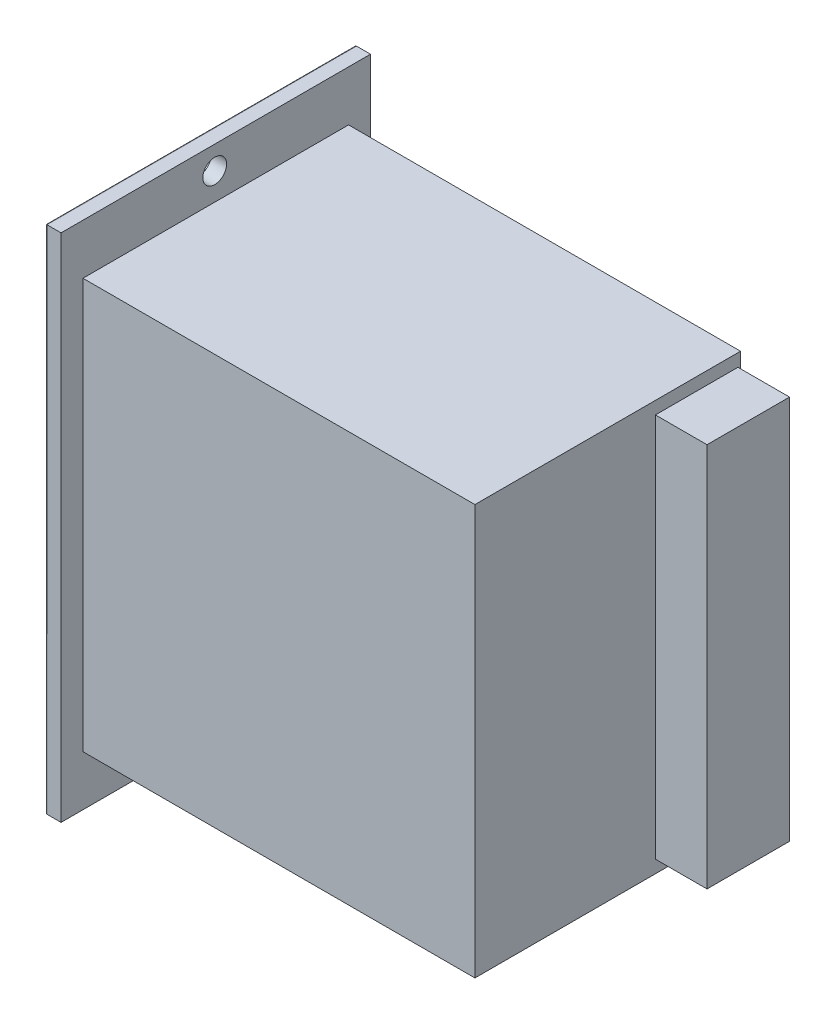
SolidWorks part; units mm, degrees
ref_plane "前视基准面" through (0, 0, 0) normal (0, 0, 1) x (1, 0, 0)
ref_plane "上视基准面" through (0, 0, 0) normal (0, 1, 0) x (1, 0, 0)
ref_plane "右视基准面" through (0, 0, 0) normal (1, 0, 0) x (0, 0, -1)
sketch "草图1" plane through (0, 0, 0) normal (1, 0, 0) x (0, 0, -1)
  line L1 (-30, -49.5) -> (30, -49.5)
  line L2 (-30, -49.5) -> (-30, 49.5)
  line L3 (-30, 49.5) -> (30, 49.5)
  line L4 (30, -49.5) -> (30, 49.5)
  line L5 (-30, -49.5) -> (30, 49.5) construction
  line L6 (-30, 49.5) -> (30, -49.5) construction
  point P0 (0, 0)
extrude "凸台-拉伸1" add sketch "草图1" along normal blind 3
sketch "草图2" plane through (3, 0, 0) normal (1, 0, 0) x (0, 0, -1)
  line L1 (-25.75, -39.75) -> (25.75, -39.75)
  line L2 (-25.75, -39.75) -> (-25.75, 39.75)
  line L3 (-25.75, 39.75) -> (25.75, 39.75)
  line L4 (25.75, -39.75) -> (25.75, 39.75)
  line L5 (-25.75, -39.75) -> (25.75, 39.75) construction
  line L6 (-25.75, 39.75) -> (25.75, -39.75) construction
  point P0 (0, 0)
extrude "凸台-拉伸2" add sketch "草图2" along normal blind 76 separate body
sketch "草图3" plane through (79, 0, 0) normal (1, 0, 0) x (0, 0, -1)
  line L3 (25.25, 37.3) -> (25.25, -37.3)
  line L4 (25.25, -37.3) -> (9.25, -37.3)
  line L5 (9.25, -37.3) -> (9.25, 37.3)
  line L6 (9.25, 37.3) -> (25.25, 37.3)
extrude "凸台-拉伸3" add sketch "草图3" along normal blind 10 separate body
sketch "草图4" plane through (0, 0, 0) normal (-1, 0, 0) x (0, 0, 1)
  line L1 (-25.5, -38.75) -> (25.5, -38.75)
  line L2 (-25.5, -38.75) -> (-25.5, 38.75)
  line L3 (-25.5, 38.75) -> (25.5, 38.75)
  line L4 (25.5, -38.75) -> (25.5, 38.75)
  line L5 (-25.5, -38.75) -> (25.5, 38.75) construction
  line L6 (-25.5, 38.75) -> (25.5, -38.75) construction
  point P0 (0, 0)
extrude "凸台-拉伸4" add sketch "草图4" along normal blind 1.6 separate body
sketch "草图5" plane through (0, 0, 0) normal (-1, 0, 0) x (0, 0, 1)
  circle A0 centre (0.2, 45) radius 2.3
  circle A1 centre (0.2, -45) radius 2.3
extrude "切除-拉伸1" cut sketch "草图5" against normal blind 3
chamfer "倒角1" distance 1.6 angle 45 4 edges at (-1.6, -38.75, 0) (-1.6, 0, -25.5) (-1.6, 38.75, 0) (-1.6, 0, 25.5)
fillet "圆角2" radius 0.3 4 edges at (0, -49.5, 0) (0, 0, 30) (0, 0, -30) (0, 49.5, 0)
